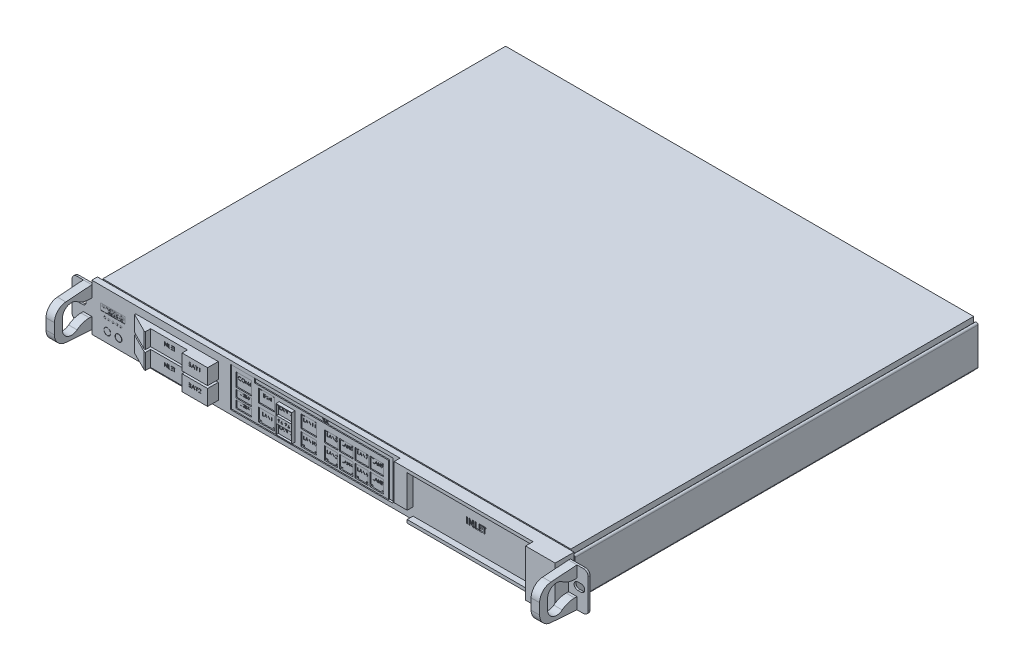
SolidWorks part; units mm, degrees
ref_plane "Front Plane" through (0, 0, 0) normal (0, 0, 1) x (1, 0, 0)
ref_plane "Top Plane" through (0, 0, 0) normal (0, 1, 0) x (1, 0, 0)
ref_plane "Right Plane" through (0, 0, 0) normal (1, 0, 0) x (0, 0, -1)
imported_body "Imported1"
ref_plane "Plane1" through (0, 0, -62.1353) normal (0, 0, -1) x (-1, 0, 0)
ref_plane "Plane2" through (-10.6011, 0, 0) normal (1, 0, 0) x (0, 0, -1)
sketch "Sketch1" plane through (0, 0, -202.1353) normal (0, 0, -1) x (-1, 0, 0)
  line L0 (-211.3739, 17.5816) -> (-211.3739, -16.7591) construction
  line L1 (-209.8489, 17.5816) -> (-209.8489, -16.7591)
  line L2 (-212.8989, 17.5816) -> (-212.8989, -16.7591)
  line L3 (-212.8989, -21.5888) -> (-212.8989, 22.4112) construction
  line L4 (-212.8989, -21.5888) -> (-212.8989, 22.4112)
  line L5 (-212.8989, -16.7591) -> (-212.8989, -21.5888)
  line L6 (-209.8489, 15.5816) -> (-208.8489, 15.5816)
  line L7 (-209.8489, 15.5816) -> (-209.8489, -14.7591)
  line L8 (-209.8489, -14.7591) -> (-208.8489, -14.7591)
  line L9 (-208.8489, 15.5816) -> (-208.8489, -14.7591)
  line L10 (-208.8489, -21.5888) -> (-208.8489, -14.7591)
  line L11 (234.1011, -21.5888) -> (-212.8989, -21.5888) construction
  line L12 (-212.8989, 17.5816) -> (-212.8989, 22.4112)
  line L13 (-212.8989, 22.4112) -> (-208.8489, 22.4112)
  line L14 (-212.8989, 22.4112) -> (234.1011, 22.4112) construction
  line L15 (-208.8489, 22.4112) -> (-208.8489, 15.5816)
  line L16 (-212.8989, -21.5888) -> (-208.8489, -21.5888)
  arc A0 (-209.8489, 17.5816) -> (-212.8989, 17.5816) centre (-211.3739, 17.5816) ccw
  arc A1 (-212.8989, -16.7591) -> (-209.8489, -16.7591) centre (-211.3739, -16.7591) ccw
  point P2 (-211.3739, 0.4112)
  point P10 (-212.8989, 0.4112)
  dimension "D1" = 3.05
  dimension "D2" = 1.525
  dimension "D3" = 34.3407
  dimension "D4" = 1
  dimension "D5" = 2
  dimension "D6" = 2
extrude "Cut-Extrude1" cut sketch "Sketch1" against normal up to surface (377.75 mm away) contours A1 L4 L16 L10 L8 L1 | A0 L1 L6 L15 L13 L4
sketch "Sketch3" plane through (0, 0, -201.1853) normal (0, 0, -1) x (-1, 0, 0)
  line L1 (215.4887, -15.006) -> (233.028, -15.006)
  line L2 (215.4887, -15.006) -> (215.4887, -21.0063)
  line L3 (215.4887, -21.0063) -> (233.028, -21.0063)
  line L4 (233.028, -15.006) -> (233.028, -21.0063)
extrude "Boss-Extrude1" add sketch "Sketch3" along normal up to surface (0.95 mm away)
sketch "Sketch4" plane through (0, 0, -202.1353) normal (0, 0, -1) x (-1, 0, 0)
  line L0 (212.1011, -17.6288) -> (230.1011, -17.6288) construction
  line L1 (212.1011, -20.3388) -> (230.1011, -20.3388) construction
  line L2 (234.1011, -21.5888) -> (-208.8489, -21.5888) construction
  line L3 (234.1011, 22.4112) -> (234.1011, -21.5888) construction
  text T0 "PROTECTIVE" font "Arial Narrow" height 2.11
  text T1 "GROUND" font "Arial Narrow" height 2.11
  dimension "D1" = 18
  dimension "D2" = 18
  dimension "D3" = 1.25
  dimension "D4" = 2.71
  dimension "D5" = 4
extrude "Cut-Extrude2" cut sketch "Sketch4" against normal blind 0.1
mirror "Mirror2" about plane through (-10.6011, 0, 0) normal (1, 0, 0) of "Cut-Extrude1"
